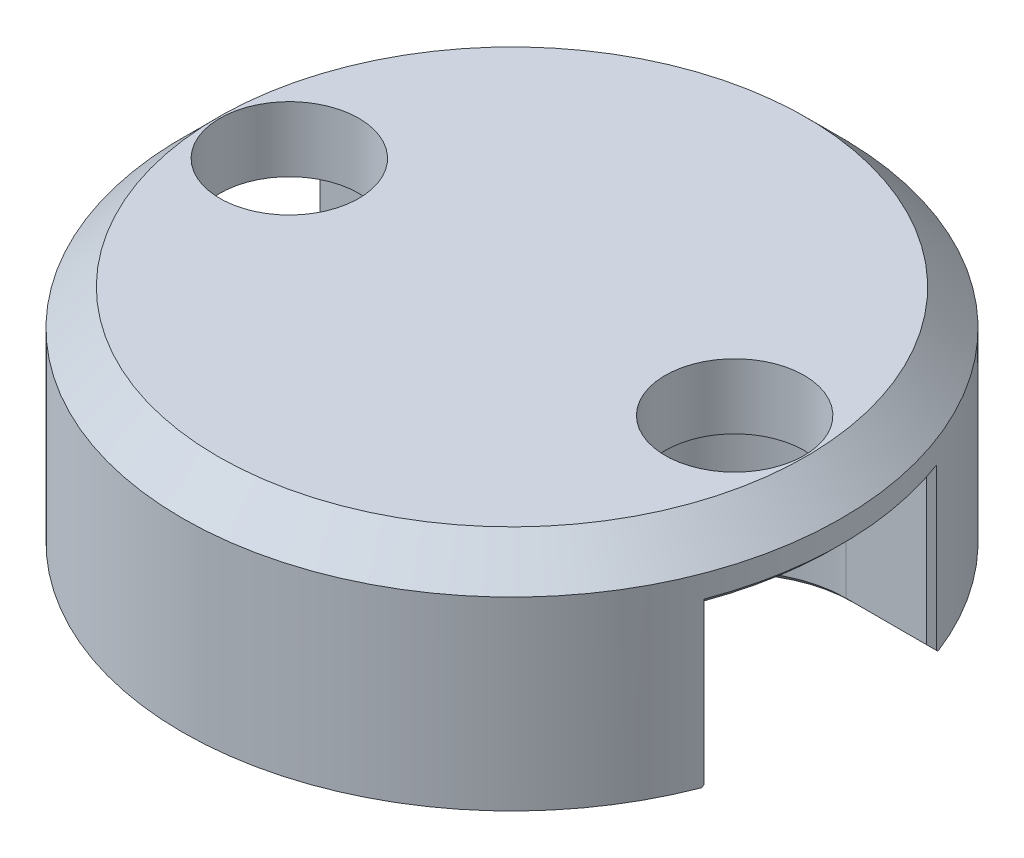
SolidWorks part; units mm, degrees
ref_plane "Front Plane" through (0, 0, 0) normal (0, 0, 1) x (1, 0, 0)
ref_plane "Top Plane" through (0, 0, 0) normal (0, 1, 0) x (1, 0, 0)
ref_plane "Right Plane" through (0, 0, 0) normal (1, 0, 0) x (0, 0, -1)
sketch "Sketch1" plane through (0, 0, 0) normal (0, 1, 0) x (1, 0, 0)
  circle A0 centre (0, 0) radius 9.398
  dimension "D1" = 18.796
extrude "Boss-Extrude1" add sketch "Sketch1" along normal blind 6.2992
hole_wizard "CBORE for #6 Socket Head Cap Screw1" positions "Sketch3" profile "Sketch2" counterbore size "#6" standard "Ansi Inch"
sketch "Sketch3" plane through (0, 0, 0) normal (0, -1, 0) x (1, 0, 0)
  line L0 (0, 0) -> (0, 50000) construction
  point P0 (6.35, 0)
  point P1 (-6.35, 0)
  dimension "D1" = 6.35
sketch "Sketch2" plane through (6.35, 0, 0) normal (1, 0, 0) x (0, 0, -1)
  line L0 (0, 0) -> (0, 6.2992)
  line L1 (0, 6.2992) -> (1.9812, 6.2992)
  line L3 (1.9812, 6.2992) -> (1.9812, 4.445)
  line L4 (1.9812, 4.445) -> (3.175, 4.445)
  line L5 (3.175, 4.445) -> (3.175, 0)
  line L7 (3.175, 0) -> (0, 0)
  line L11 (0, -6.35) -> (0, 107.95) construction
  dimension "Thru Hole Dia." = 3.9624
  dimension "Thru Hole Depth" = 6.2992
  dimension "C'Bore Dia." = 6.35
  dimension "C'Bore Depth" = 4.445
sketch "Sketch4" plane through (0, 0, 0) normal (0, -1, 0) x (1, 0, 0)
  line L0 (0, 0) -> (0, 50000) construction
  line L1 (6.35, 3.175) -> (12.7, 3.175)
  line L2 (6.35, -3.175) -> (12.7, -3.175)
  line L3 (12.7, 3.175) -> (12.7, -3.175)
  line L4 (-12.7, 3.175) -> (-12.7, -3.175)
  line L5 (-6.35, -3.175) -> (-12.7, -3.175)
  line L6 (-6.35, 3.175) -> (-12.7, 3.175)
  circle A0 centre (6.35, 0) radius 3.175 construction
  arc A1 (6.35, 3.175) -> (6.35, -3.175) centre (6.35, 0) ccw
  arc A2 (-6.35, 3.175) -> (-6.35, -3.175) centre (-6.35, 0) cw
  dimension "D1" = 6.35
extrude "Cut-Extrude1" cut sketch "Sketch4" against normal up to surface (4.445 mm away)
sketch "Sketch5" plane through (0, 0, 0) normal (1, 0, 0) x (0, 0, -1)
  line L0 (0, 0) -> (0, 50000) construction
  line L1 (-9.398, 0) -> (-3.175, 0) construction
  line L2 (-1.9784, 0) -> (-1.1225, 0.8558)
  line L3 (1.9784, 0) -> (1.1225, 0.8558)
  line L4 (-1.9784, 0) -> (1.9784, 0)
  arc A0 (-1.1225, 0.8558) -> (1.1225, 0.8558) centre (0, -0.2667) cw
  point P10 (0, 1.9784)
  dimension "D3" = 1.5875
  dimension "D2" = 1.3208
  dimension "D1" = 45
extrude "Cut-Extrude2" cut sketch "Sketch5" against normal mid plane 12.7
chamfer "Chamfer1" distance 0.1984 angle 45 20 edges at (3.59, 0.4089, -1.5694) (3.59, 0.4089, 1.5694) (4.9717, 0, 2.8602) (7.5977, 0, 3.175) (4.9717, 0, -2.8602) (7.5977, 0, -3.175) (8.8454, 2.2225, -3.175) (8.8454, 2.2225, 3.175) (9.398, 4.445, 0) (-8.8454, 2.2225, -3.175) (-9.398, 4.445, 0) (-8.8454, 2.2225, 3.175) (-7.5977, 0, 3.175) (-4.9717, 0, 2.8602) (-3.59, 0.4089, 1.5694) (-3.59, 0.4089, -1.5694) (-4.9717, 0, -2.8602) (-7.5977, 0, -3.175) (3.1802, 1.3103, 0.1819) (-3.1802, 1.3103, -0.1819)
chamfer "Chamfer2" distance 1.016 angle 45 1 edges at (0, 6.2992, 9.398)
